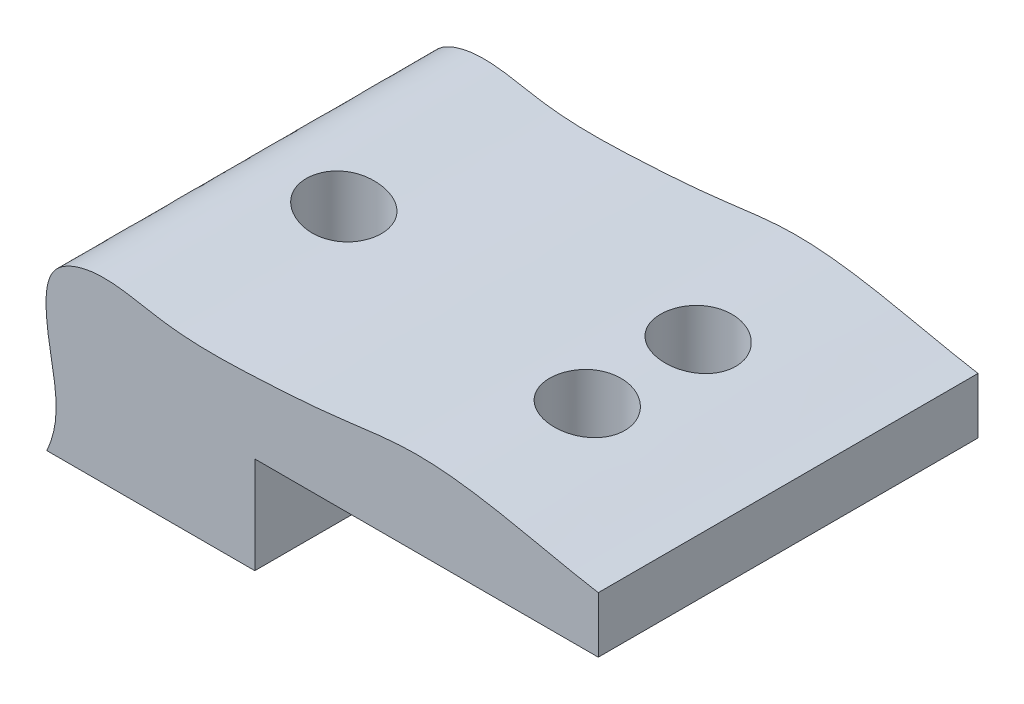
SolidWorks part; units mm, degrees
ref_plane "Plan de face" through (0, 0, 0) normal (0, 0, 1) x (1, 0, 0)
ref_plane "Plan de dessus" through (0, 0, 0) normal (0, 1, 0) x (1, 0, 0)
ref_plane "Plan de droite" through (0, 0, 0) normal (1, 0, 0) x (0, 0, -1)
sketch "Esquisse1" plane through (0, 0, 0) normal (0, 0, 1) x (1, 0, 0)
  line L0 (-301.0805, 81.5) -> (-190.3352, 81.5)
  line L1 (-190.3352, 81.5) -> (-190.3352, 133)
  line L2 (-190.3352, 133) -> (-7.6219, 133)
  line L3 (-7.6219, 133) -> (-7.6219, 162.7553)
  line L6 (-124, 133) -> (-116.7942, 133) construction
  line L7 (-279, 81.5) -> (-207, 81.5) construction
  spline S0 degree 3 poles (-301.0805, 81.5) (-290.5519, 103.6717) (-302.9388, 128.1568) (-301.1136, 167.5569) (-273.2227, 180.0563) (-237.4838, 169.2253) (-192.0676, 170.427) (-148.4872, 173.311) (-87.4452, 183.0881) (-40.7298, 168.3286) (-7.6219, 162.7553) knots 0 0 0 0 0.165588 0.228412 0.273018 0.383065 0.514093 0.630987 0.728953 1 1 1 1
extrude "Boss.-Extru.1" add sketch "Esquisse1" along normal blind 100 and the other way blind 102
sketch "Esquisse2" plane through (0, 81.5, 0) normal (0, -1, 0) x (1, 0, 0)
  circle A0 centre (-243, 0) radius 20
  dimension "D1" = 40
extrude "Enlèv. mat.-Extru.1" cut sketch "Esquisse2" against normal through all
sketch "Esquisse3" plane through (0, 133, 0) normal (0, -1, 0) x (1, 0, 0)
  circle A0 centre (-84, 29.5) radius 20
  circle A1 centre (-84, -29.5) radius 20
  dimension "D1" = 40
  dimension "D2" = 40
extrude "Enlèv. mat.-Extru.2" cut sketch "Esquisse3" against normal through all
hole_wizard "Trou taraudé M101" positions "Esquisse5" profile "Esquisse4" tap size "M10" standard "ISO"
sketch "Esquisse5" plane through (0, 81.5, 0) normal (0, -1, 0) x (-1, 0, 0)
  point P0 (217, 50)
  point P3 (269, 50)
  point P6 (269, -50)
  point P9 (217, -50)
sketch "Esquisse4" plane through (-217, 81.5, -50) normal (1, 0, 0) x (0, 0, -1)
  line L0 (0, 0) -> (0, 32.5537)
  line L1 (0, 32.5537) -> (4.25, 30)
  line L2 (4.25, 30) -> (4.25, 0)
  line L5 (4.25, 0) -> (0, 0)
  line L10 (0, 32.5537) -> (-4.25, 30) construction
  line L11 (0, -6.35) -> (0, 107.95) construction
  dimension "Diamètre du trou pour taraudage" = 8.5
  dimension "Profondeur du trou pour taraudage" = 30
  dimension "Angle de pointe" = 118
hole_wizard "Trou taraudé M102" positions "Esquisse7" profile "Esquisse6" tap size "M10" standard "ISO"
sketch "Esquisse7" plane through (0, 133, 0) normal (0, -1, 0) x (-1, 0, 0)
  point P0 (79, -84.5)
  point P3 (109, -84.5)
  point P6 (59, 84.5)
  point P14 (109, 84.5)
sketch "Esquisse6" plane through (-79, 133, 84.5) normal (1, 0, 0) x (0, 0, -1)
  line L0 (0, 0) -> (0, 27.5537)
  line L1 (0, 27.5537) -> (4.25, 25)
  line L2 (4.25, 25) -> (4.25, 0)
  line L5 (4.25, 0) -> (0, 0)
  line L10 (0, 27.5537) -> (-4.25, 25) construction
  line L11 (0, -6.35) -> (0, 107.95) construction
  dimension "Diamètre du trou pour taraudage" = 8.5
  dimension "Profondeur du trou pour taraudage" = 25
  dimension "Angle de pointe" = 118
